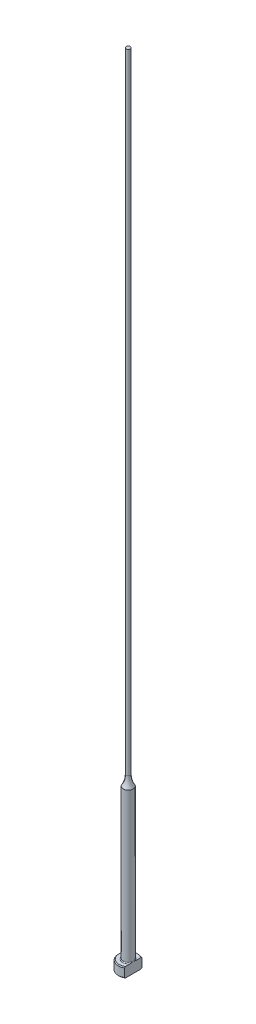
SolidWorks part; units mm, degrees
ref_plane "Front Plane" through (0, 0, 0) normal (0, 0, 1) x (1, 0, 0)
ref_plane "Top Plane" through (0, 0, 0) normal (0, 1, 0) x (1, 0, 0)
ref_plane "Right Plane" through (0, 0, 0) normal (1, 0, 0) x (0, 0, -1)
sketch "Sketch1" plane through (0, 0, 0) normal (0, 0, 1) x (1, 0, 0)
  line L0 (0, 259.9588) -> (0, -15.1925) construction
  line L1 (0, 0) -> (-3.175, 0)
  line L2 (-3.175, 0) -> (-3.175, 3.175)
  line L3 (-3.175, 3.175) -> (-1.5875, 3.175)
  line L4 (-0.6579, 54.1079) -> (-0.6579, 254)
  line L5 (-0.6579, 254) -> (0, 254)
  line L6 (0, 254) -> (0, 0)
  line L7 (-1.5875, 3.175) -> (-1.5875, 50.8)
  arc A0 (-1.5875, 50.8) -> (-0.6579, 54.1079) centre (-7.0079, 54.1079) ccw
  point P13 (-1.5875, 0)
  dimension "D1" = 6.35
  dimension "L" = 254
  dimension "D2" = 3.175
  dimension "H" = 6.35
  dimension "T" = 3.175
  dimension "D" = 1.3157
  dimension "S" = 50.8
revolve "Revolve1" add sketch "Sketch1" angle 360 about L0
chamfer "Chamfer1" distance 0.254 angle 45 2 edges at (0, 3.175, 3.175) (0, 0, 3.175)
fillet "Fillet1" radius 0.254 1 edges at (0, 3.175, 1.5875)
sketch "Sketch2" plane through (0, 0, 0) normal (0, 1, 0) x (1, 0, 0)
  line L0 (1.5875, -2.7496) -> (1.5875, 2.7496)
  circle A0 centre (0, 0) radius 3.175 construction
  arc A2 (1.5875, -2.7496) -> (1.5875, 2.7496) centre (0, 0) ccw
  circle A3 centre (0, 0) radius 3.175 construction
  circle A4 centre (0, 0) radius 1.5875 construction
extrude "Key Head" cut sketch "Sketch2" along normal up to next
